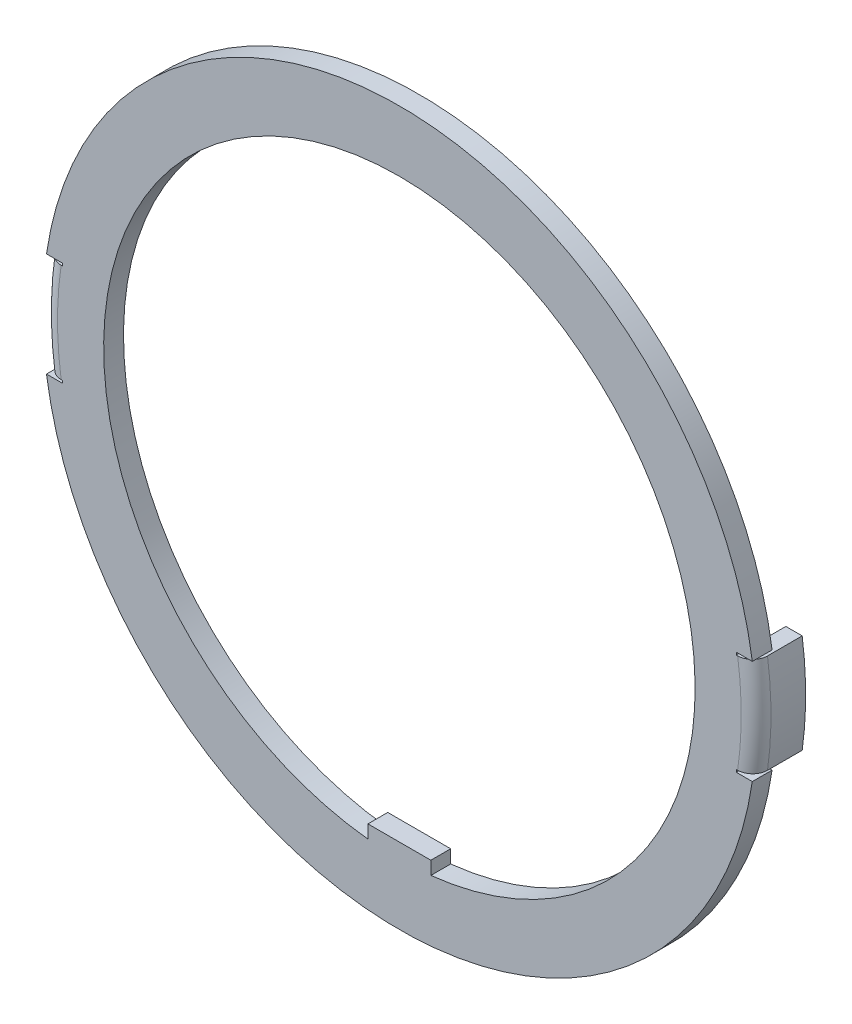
SolidWorks part; units mm, degrees
ref_plane "Front Plane" through (0, 0, 0) normal (0, 0, 1) x (1, 0, 0)
ref_plane "Top Plane" through (0, 0, 0) normal (0, 1, 0) x (1, 0, 0)
ref_plane "Right Plane" through (0, 0, 0) normal (1, 0, 0) x (0, 0, -1)
sketch "Sketch1" plane through (0, 0, 0) normal (0, 0, 1) x (1, 0, 0)
  line L0 (-1.5875, -14.8378) -> (-1.5875, -14.1725)
  line L1 (-1.5875, -14.1725) -> (1.5875, -14.1725)
  line L2 (1.5875, -14.1725) -> (1.5875, -14.8378)
  line L3 (0, 0) -> (0, -14.1725) construction
  line L4 (0, -14.1725) -> (0, -18) construction
  arc A0 (1.5875, -14.8378) -> (-1.5875, -14.8378) centre (0, 0) ccw
  circle A1 centre (0, 0) radius 18
  point P7 (0, -14.9225)
  dimension "D1" = 29.845
  dimension "D4" = 36
  dimension "D2" = 0.75
  dimension "D3" = 3.175
extrude "Boss-Extrude1" add sketch "Sketch1" along normal blind 1
sketch "Sketch2" plane through (0, 0, 0) normal (0, 0, -1) x (-1, 0, 0)
  line L1 (17.0005, 2.5) -> (17.8255, 2.5)
  line L2 (17.0005, 2.5) -> (17.0005, -2.5)
  line L3 (17.0005, -2.5) -> (17.8255, -2.5)
  line L5 (0, -9.4204) -> (0, 9.4204) construction
  line L6 (-17.0005, -2.5) -> (-17.8255, -2.5)
  line L7 (-17.0005, 2.5) -> (-17.0005, -2.5)
  line L8 (-17.0005, 2.5) -> (-17.8255, 2.5)
  line L9 (17.0005, 0) -> (0, 0) construction
  circle A1 centre (0, 0) radius 18 construction
  arc A2 (17.8255, 2.5) -> (17.8255, -2.5) centre (0, 0) cw
  arc A3 (-17.8255, 2.5) -> (-17.8255, -2.5) centre (0, 0) ccw
  dimension "D3" = 18
  dimension "D1" = 5
  dimension "D2" = 0.825
extrude "Boss-Extrude2" add sketch "Sketch2" along normal blind 1.5
sketch "Sketch3" plane through (0, 0, 1) normal (0, 0, 1) x (1, 0, 0)
  line L0 (18.5, -2.5625) -> (18.9461, -2.5625) construction
  line L1 (18.9461, 2.625) -> (17.0005, 2.625)
  line L2 (18.9461, 2.625) -> (18.9461, 2.5)
  line L3 (18.9461, 2.5) -> (17.0005, 2.5)
  line L4 (17.0005, 2.625) -> (17.0005, 2.5)
  line L5 (17.0005, -2.5) -> (18.9461, -2.5)
  line L6 (17.0005, -2.5) -> (17.0005, -2.625)
  line L7 (17.0005, -2.625) -> (18.9461, -2.625)
  line L8 (18.9461, -2.5) -> (18.9461, -2.625)
  line L9 (18.5, 2.5625) -> (18.9461, 2.5625) construction
  line L10 (0, 6.1984) -> (0, -6.1984) construction
  line L11 (-18.5, 2.5625) -> (-18.9461, 2.5625) construction
  line L12 (-18.5, -2.5625) -> (-18.9461, -2.5625) construction
  line L13 (-18.9461, -2.5) -> (-18.9461, -2.625)
  line L14 (-17.0005, -2.625) -> (-18.9461, -2.625)
  line L15 (-17.0005, -2.5) -> (-17.0005, -2.625)
  line L16 (-17.0005, -2.5) -> (-18.9461, -2.5)
  line L17 (-17.0005, 2.625) -> (-17.0005, 2.5)
  line L18 (-18.9461, 2.5) -> (-17.0005, 2.5)
  line L19 (-18.9461, 2.625) -> (-18.9461, 2.5)
  line L20 (-18.9461, 2.625) -> (-17.0005, 2.625)
  line L21 (17.0005, 2.5) -> (17.8255, 2.5) construction
  line L22 (17.8255, -2.5) -> (17.0005, -2.5) construction
  dimension "D1" = 0.125
extrude "Cut-Extrude1" cut sketch "Sketch3" against normal up to vertex (1 mm away)
fillet "Fillet1" radius 0.75 2 edges at (18, 0, 1) (-18, 0, 1)
